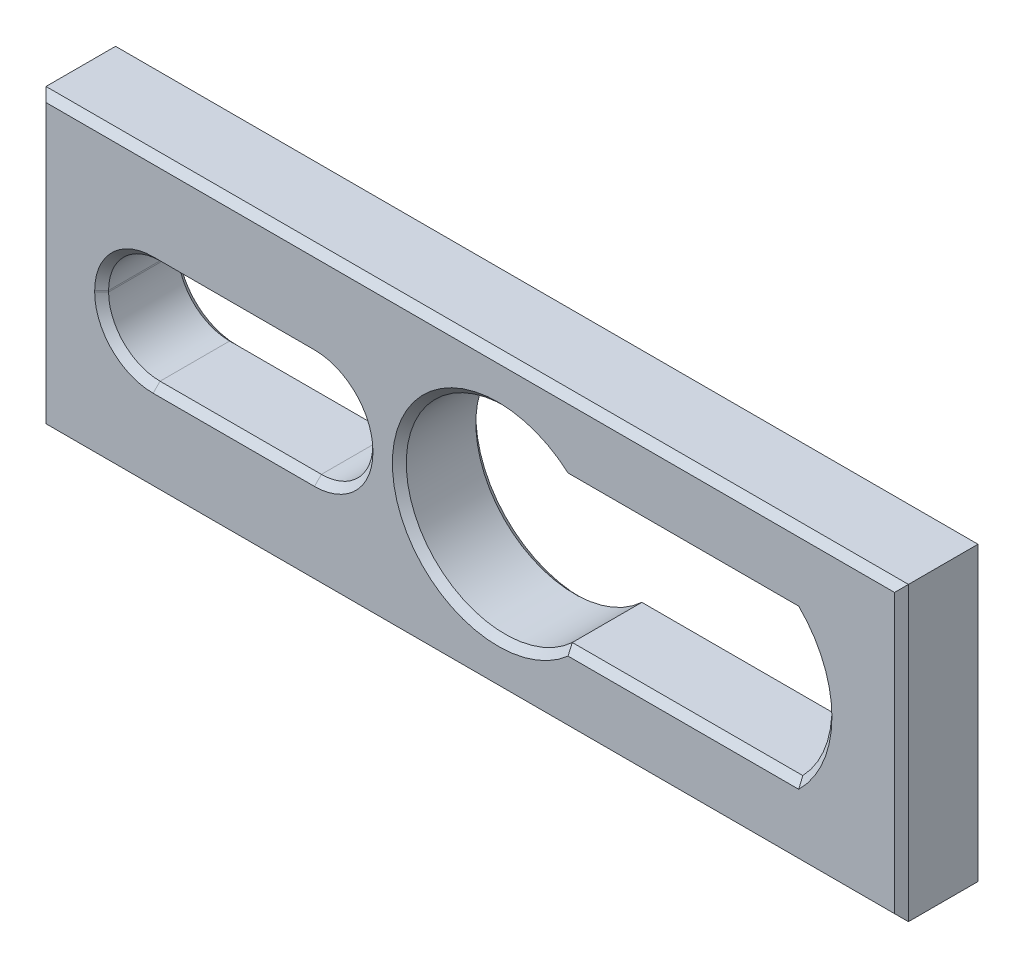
SolidWorks part; units mm, degrees
ref_plane "Спереди" through (0, 0, 0) normal (0, 0, 1) x (1, 0, 0)
ref_plane "Сверху" through (0, 0, 0) normal (0, 1, 0) x (1, 0, 0)
ref_plane "Справа" through (0, 0, 0) normal (1, 0, 0) x (0, 0, -1)
sketch "Эскиз1" plane through (0, 0, 0) normal (0, 0, 1) x (1, 0, 0)
  line L1 (-31, 10.5) -> (31, 10.5)
  line L2 (-31, 10.5) -> (-31, -10.5)
  line L3 (-31, -10.5) -> (31, -10.5)
  line L4 (31, 10.5) -> (31, -10.5)
  line L5 (0, -10.5) -> (0, 10.5) construction
  line L6 (-31, 0) -> (31, 0) construction
  point P0 (0, 0)
  dimension "D1" = 21
  dimension "D2" = 62
extrude "Бобышка-Вытянуть1" add sketch "Эскиз1" along normal blind 6
sketch "Эскиз2" plane through (0, 0, 6) normal (0, 0, 1) x (1, 0, 0)
  line L0 (-31, 0) -> (31, 0) construction
  line L1 (-31, 10.5) -> (-31, -10.5) construction
  line L2 (31, -10.5) -> (31, 10.5) construction
  line L4 (-22.8, 3.75) -> (-11.2, 3.75)
  line L5 (-26.5, 0.05) -> (-26.5, -0.05)
  line L6 (-22.8, -3.75) -> (-11.2, -3.75)
  line L7 (-7.5, 0.05) -> (-7.5, -0.05)
  line L8 (-17, -3.75) -> (-17, 3.75) construction
  line L9 (-26.5, 0) -> (-7.5, 0) construction
  arc A0 (-26.5, -0.05) -> (-22.8, -3.75) centre (-22.8, -0.05) ccw
  arc A1 (-11.2, -3.75) -> (-7.5, -0.05) centre (-11.2, -0.05) ccw
  arc A2 (-11.2, 3.75) -> (-7.5, 0.05) centre (-11.2, 0.05) cw
  arc A3 (-22.8, 3.75) -> (-26.5, 0.05) centre (-22.8, 0.05) ccw
  circle A4 centre (2, 0) radius 7.1
  point P6 (-17, 0)
  point P12 (-26.5, -3.75)
  point P20 (-7.5, 3.75)
  point P23 (-26.5, 3.75)
  dimension "D4" = 3.7
  dimension "D5" = 14.2
  dimension "D1" = 7.5
  dimension "D2" = 19
  dimension "D3" = 4.5
  dimension "D6" = 33
extrude "Вырез-Вытянуть1" cut sketch "Эскиз2" against normal blind 6
sketch "Эскиз3" plane through (0, 0, 6) normal (0, 0, 1) x (1, 0, 0)
  line L0 (0, 0) -> (31, 0) construction
  line L1 (31, -10.5) -> (31, 10.5) construction
  line L2 (23.4046, 5.2) -> (4.5, 5.2)
  line L3 (4.5, 5.2) -> (25.5, 5.2) construction
  line L4 (4.5, 5.2) -> (4.5, -5.2) construction
  line L5 (4.5, -5.2) -> (25.5, -5.2) construction
  line L6 (25.5, 5.2) -> (25.5, -5.2) construction
  line L7 (15, -5.2) -> (15, 5.2) construction
  line L8 (4.5, 0) -> (25.5, 0) construction
  line L9 (4.5, 5.2) -> (4.5, -5.2)
  line L10 (4.5, -5.2) -> (23.4046, -5.2)
  arc A0 (23.4046, 5.2) -> (23.4046, -5.2) centre (18, 0) cw
  point P5 (15, 0)
  dimension "D4" = 7.5
  dimension "D1" = 10.4
  dimension "D2" = 21
  dimension "D3" = 5.5
extrude "Вырез-Вытянуть2" cut sketch "Эскиз3" against normal blind 6
chamfer "Фаска1" distance 0.5 angle 45 32 edges at (0, 10.5, 0) (-31, 0, 0) (0, -10.5, 0) (31, 0, 0) (15.1194, -5.2, 0) (-5.1, 0, 0) (15.1194, 5.2, 0) (25.5, 0, 0) (-25.4163, 2.6663, 0) (-17, 3.75, 0) (-8.5837, 2.6663, 0) (-7.5, 0, 0) (-8.5837, -2.6663, 0) (-17, -3.75, 0) (-25.4163, -2.6663, 0) (-26.5, 0, 0) (0, -10.5, 6) (-31, 0, 6) (0, 10.5, 6) (31, 0, 6) (-17, -3.75, 6) (-8.5837, -2.6663, 6) (-7.5, 0, 6) (-8.5837, 2.6663, 6) (-17, 3.75, 6) (-25.4163, 2.6663, 6) (-26.5, 0, 6) (-25.4163, -2.6663, 6) (-5.1, 0, 6) (15.1194, -5.2, 6) (25.5, 0, 6) (15.1194, 5.2, 6)
